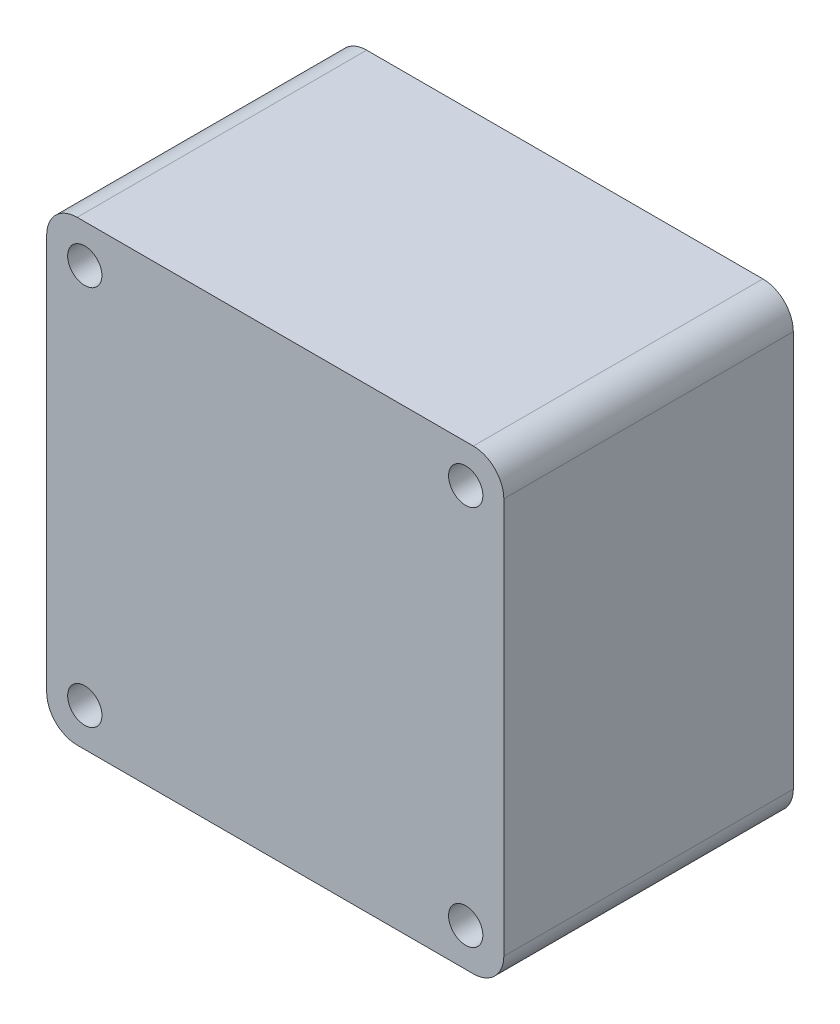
SolidWorks part; units mm, degrees
ref_plane "Front Plane" through (0, 0, 0) normal (0, 0, 1) x (1, 0, 0)
ref_plane "Top Plane" through (0, 0, 0) normal (0, 1, 0) x (1, 0, 0)
ref_plane "Right Plane" through (0, 0, 0) normal (1, 0, 0) x (0, 0, -1)
sketch "Sketch1" plane through (0, 0, 0) normal (0, 0, 1) x (1, 0, 0)
  line L2 (-639.194, 899.236) -> (-656.4394, 899.236)
  line L11 (-664.7169, 894.2712) -> (-664.9552, 894.1258)
  line L12 (-678.4081, 872.3204) -> (-678.1931, 872.4214)
  line L13 (-679.3284, 880.8061) -> (-679.3283, 872.3256)
  line L19 (-664.0462, 899.9538) -> (-661.3462, 899.9538)
  line L27 (-661.3462, 898.2538) -> (-660.5494, 898.2538)
  line L29 (-664.0462, 899.9538) -> (-676.0462, 899.9538)
  line L30 (-680.0462, 895.9538) -> (-680.0462, 843.9538)
  line L31 (-676.0462, 839.9538) -> (-624.0462, 839.9538)
  line L32 (-620.0462, 843.9538) -> (-620.0462, 895.9538)
  line L33 (-624.0462, 899.9538) -> (-661.3462, 899.9538)
  arc A3 (-624.7154, 889.7827) -> (-633.9549, 897.8088) centre (-650.0462, 869.9538) ccw
  arc A4 (-655.6236, 897.6473) -> (-655.9766, 898.0283) centre (-694.3478, 862.1237) ccw
  arc A10 (-663.5061, 894.1347) -> (-664.7169, 894.2712) centre (-664.2003, 893.4149) ccw
  arc A14 (-675.0462, 897.2038) -> (-675.0462, 892.7038) centre (-675.0462, 894.9538) ccw
  arc A15 (-675.0462, 892.7038) -> (-675.0462, 897.2038) centre (-675.0462, 894.9538) ccw
  arc A18 (-625.0462, 897.2038) -> (-625.0462, 892.7038) centre (-625.0462, 894.9538) ccw
  arc A19 (-625.0462, 892.7038) -> (-625.0462, 897.2038) centre (-625.0462, 894.9538) ccw
  arc A22 (-625.0462, 847.2038) -> (-625.0462, 842.7038) centre (-625.0462, 844.9538) ccw
  arc A23 (-625.0462, 842.7038) -> (-625.0462, 847.2038) centre (-625.0462, 844.9538) ccw
  arc A26 (-675.0462, 847.2038) -> (-675.0462, 842.7038) centre (-675.0462, 844.9538) ccw
  arc A27 (-675.0462, 842.7038) -> (-675.0462, 847.2038) centre (-675.0462, 844.9538) ccw
  arc A44 (-650.0462, 853.4538) -> (-633.5462, 869.9538) centre (-650.0462, 869.9538) ccw
  arc A45 (-656.3626, 885.197) -> (-650.0462, 853.4538) centre (-650.0462, 869.9538) ccw
  arc A46 (-656.3626, 885.197) -> (-656.7718, 887.6864) centre (-659.253, 886.0002) ccw
  arc A47 (-656.7718, 887.6864) -> (-664.61, 896.4979) centre (-694.3626, 862.1397) ccw
  arc A48 (-664.0462, 898.2497) -> (-664.61, 896.4979) centre (-663.9554, 897.2538) ccw
  arc A49 (-676.0462, 899.9538) -> (-680.0462, 895.9538) centre (-676.0462, 895.9538) ccw
  arc A50 (-680.0462, 843.9538) -> (-676.0462, 839.9538) centre (-676.0462, 843.9538) ccw
  arc A51 (-624.0462, 839.9538) -> (-620.0462, 843.9538) centre (-624.0462, 843.9538) ccw
  arc A52 (-620.0462, 895.9538) -> (-624.0462, 899.9538) centre (-624.0462, 895.9538) ccw
  parabola Q2
  parabola Q15
  parabola Q16
  parabola Q17
  parabola Q18
  parabola Q19
  spline S13 degree 2 poles (-656.4394, 899.236) (-656.341, 898.8226) (-656.2731, 898.6049) (-656.1515, 898.215) (-655.9766, 898.0283) knots 0 0 0 0.5 0.5 1 1 1
  spline S14 degree 2 poles (-633.9549, 897.8088) (-635.1568, 898.5031) (-636.4811, 898.8665) (-637.8091, 899.231) (-639.194, 899.236) knots 0 0 0 0.5 0.5 1 1 1
  spline S15 degree 2 poles (-634.2005, 875.2266) (-631.2149, 878.4303) (-628.8278, 882.094) (-626.4325, 885.7702) (-624.7154, 889.7827) knots 0 0 0 0.5 0.5 1 1 1
  spline S16 degree 3 poles (-644.4131, 885.6751) (-643.2177, 885.2456) (-642.0897, 884.6906) (-640.764, 883.84) (-640.5014, 883.6609) (-639.4804, 882.9215) (-638.7662, 882.3051) (-637.9932, 881.514) (-637.8863, 881.4016) (-637.0382, 880.484) (-636.3812, 879.616) (-635.7685, 878.6164) (-635.7266, 878.5468) (-635.0763, 877.4512) (-634.5811, 876.3673) (-634.2005, 875.2266) knots 0 0 0 0 0.25 0.25 0.3125 0.3125 0.5 0.5 0.53125 0.53125 0.75 0.75 0.765625 0.765625 1 1 1 1 weights 1 1 1 1 1 1 1 1 1 1 1 1 1 1 1 1
  spline S17 degree 2 poles (-650.2576, 888.8253) (-649.8411, 888.1319) (-649.0656, 887.651) (-648.4703, 887.2818) (-647.536, 886.9443) (-645.5738, 886.2355) (-644.4131, 885.6751) knots 0 0 0 0.25 0.25 0.5 0.5 1 1 1
  spline S18 degree 2 poles (-655.6236, 897.6473) (-655.7793, 897.5092) (-655.8679, 897.3251) (-655.9492, 897.156) (-655.9628, 896.9748) (-655.9777, 896.7777) (-655.9152, 896.5939) (-655.8524, 896.4094) (-655.7228, 896.2625) knots 0 0 0 0.25 0.25 0.5 0.5 0.75 0.75 1 1 1
  spline S48 degree 2 poles (-667.3838, 896.1995) (-667.5683, 896.3468) (-667.8613, 896.3771) (-668.1049, 896.4023) (-668.4128, 896.3641) knots 0 0 0 0.5 0.5 1 1 1
  spline S49 degree 3 poles (-664.3641, 878.5496) (-663.6184, 879.7903) (-662.7311, 880.9115) (-661.445, 882.1637) (-661.1789, 882.4068) (-660.0908, 883.3387) (-659.2123, 883.9547) (-658.2715, 884.4879) knots 0 0 0 0 0.5 0.5 0.625 0.625 1 1 1 1 weights 1 1 1 1 1 1 1 1
  spline S50 degree 2 poles (-668.056, 874.8914) (-667.4413, 875.0364) (-666.8861, 875.4914) (-666.4738, 875.8293) (-665.9787, 876.4522) (-665.7913, 876.6879) (-665.5873, 876.9623) (-665.3824, 877.238) (-665.1802, 877.5077) (-664.9718, 877.7855) (-664.772, 878.0406) (-664.5451, 878.3302) (-664.4779, 878.4103) (-664.4198, 878.4795) (-664.3641, 878.5496) knots 0 0 0 0.25 0.25 0.5 0.5 0.625 0.625 0.75 0.75 0.875 0.875 0.9375 0.9375 1 1 1
  spline S51 degree 2 poles (-678.1931, 872.4214) (-677.9968, 872.0366) (-677.6417, 871.8983) (-677.2656, 871.7519) (-676.8903, 871.9179) knots 0 0 0 0.5 0.5 1 1 1
  spline S52 degree 2 poles (-677.9012, 886.0452) (-678.5955, 884.8433) (-678.9589, 883.519) (-679.3234, 882.1909) (-679.3284, 880.8061) knots 0 0 0 0.5 0.5 1 1 1
  spline S53 degree 3 poles (-668.4128, 896.3641) (-670.332, 895.0295) (-672.1267, 893.4672) (-675.3277, 889.9856) (-676.7331, 888.0672) (-677.9012, 886.0452) knots 0 0 0 0 0.5 0.5 1 1 1 1 weights 1 1 1 1 1 1
  spline S56 degree 2 poles (-660.5494, 898.2538) (-659.87, 898.2538) (-659.2512, 898.0035) (-658.6175, 897.7472) (-658.1532, 897.2691) knots 0 0 0 0.5 0.5 1 1 1
  spline S57 degree 2 poles (-658.1532, 897.2691) (-656.1374, 895.1914) (-654.3715, 892.8955) (-652.6066, 890.6008) (-651.1152, 888.1178) knots 0 0 0 0.5 0.5 1 1 1
  spline S58 degree 2 poles (-651.1152, 888.1178) (-650.8306, 887.6436) (-650.4626, 887.2217) (-650.0966, 886.8019) (-649.6599, 886.4491) knots 0 0 0 0.5 0.5 1 1 1
  spline S59 degree 2 poles (-649.6599, 886.4491) (-648.0608, 886.4119) (-646.4962, 886.0674) (-644.9346, 885.7235) (-643.4651, 885.0846) (-641.9987, 884.4469) (-640.6794, 883.5374) (-639.3629, 882.6298) (-638.2431, 881.4836) (-637.1256, 880.3399) (-636.247, 878.9999) (-635.3702, 877.6626) (-634.7655, 876.1787) (-634.1621, 874.6979) (-633.8539, 873.1254) (-633.5462, 871.5554) (-633.5462, 869.9538) knots 0 0 0 0.125 0.125 0.25 0.25 0.375 0.375 0.5 0.5 0.625 0.625 0.75 0.75 0.875 0.875 1 1 1
extrude "Boss-Extrude1" add sketch "Sketch1" against normal up to surface (38 mm away)
